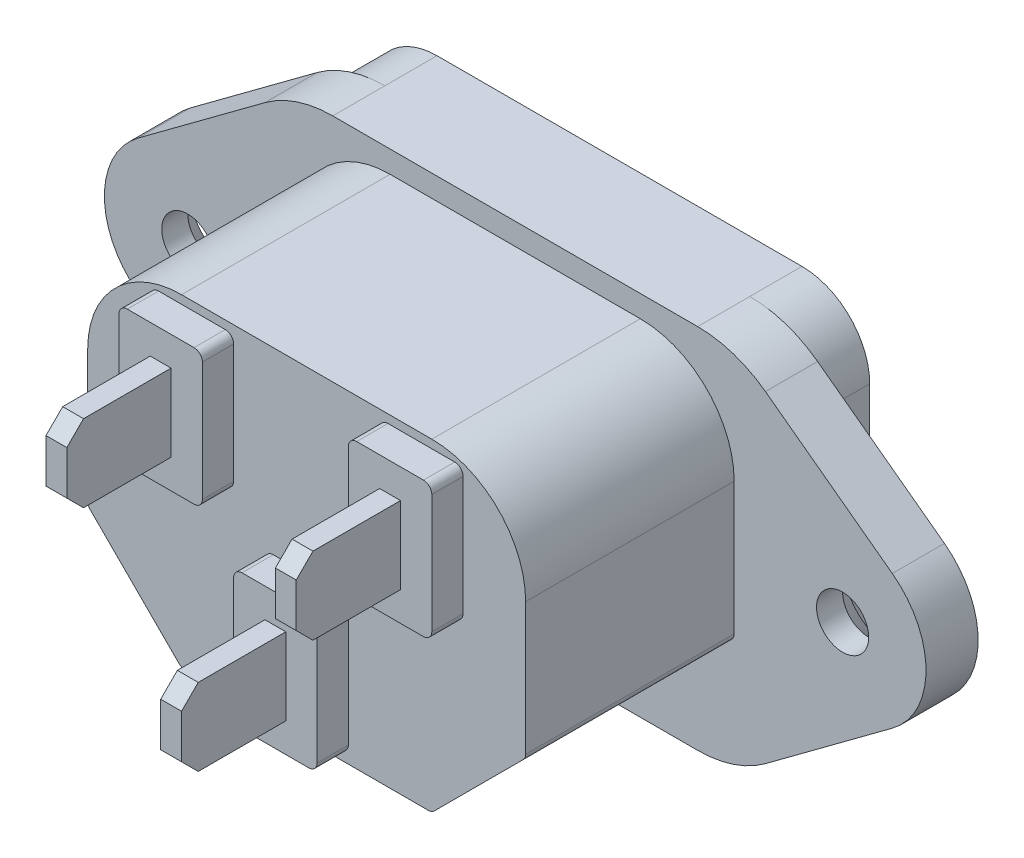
SolidWorks part; units mm, degrees
ref_plane "Front Plane" through (0, 0, 0) normal (0, 0, 1) x (1, 0, 0)
ref_plane "Top Plane" through (0, 0, 0) normal (0, 1, 0) x (1, 0, 0)
ref_plane "Right Plane" through (0, 0, 0) normal (1, 0, 0) x (0, 0, -1)
sketch "Sketch1" plane through (0, 0, 0) normal (0, 0, 1) x (1, 0, 0)
  line L0 (11.1125, 11.176) -> (-11.1125, 11.176)
  line L1 (11.1125, -11.176) -> (-11.1125, -11.176)
  line L2 (15.24, 9.812) -> (22.966, 4.0797)
  line L3 (15.24, -9.812) -> (22.966, -4.0797)
  line L4 (-15.24, 9.812) -> (-22.966, 4.0797)
  line L5 (-15.24, -9.812) -> (-22.966, -4.0797)
  line L6 (19.939, 0) -> (-19.939, 0) construction
  line L7 (0, 11.176) -> (0, -11.176) construction
  arc A0 (22.966, 4.0797) -> (22.966, -4.0797) centre (19.939, 0) cw
  arc A1 (-22.966, 4.0797) -> (-22.966, -4.0797) centre (-19.939, 0) ccw
  arc A2 (15.24, 9.812) -> (11.1125, 11.176) centre (11.1125, 4.249) ccw
  arc A3 (-11.1125, 11.176) -> (-15.24, 9.812) centre (-11.1125, 4.249) ccw
  arc A4 (-15.24, -9.812) -> (-11.1125, -11.176) centre (-11.1125, -4.249) ccw
  arc A5 (11.1125, -11.176) -> (15.24, -9.812) centre (11.1125, -4.249) ccw
  point P13 (0, 11.176)
  dimension "D3" = 22.352
  dimension "D2" = 50.038
  dimension "D4" = 5.08
  dimension "D1" = 22.225
  dimension "D6" = 30.48
extrude "Base-Extrude" add sketch "Sketch1" along normal blind 3.175
sketch "Sketch2" plane through (0, 0, 0) normal (0, 0, -1) x (-1, 0, 0)
  circle A0 centre (19.939, 0) radius 1.5875
  circle A1 centre (-19.939, 0) radius 1.5875
  dimension "D1" = 3.175
extrude "Cut-Extrude1" cut sketch "Sketch2" against normal through all
chamfer "Chamfer1" distance 1.5875 angle 45 2 edges at (-21.5265, 0, 0) (18.3515, 0, 0)
sketch "Sketch3" plane through (0, 0, 0) normal (0, 0, -1) x (-1, 0, 0)
  line L0 (-11.1125, 11.176) -> (11.1125, 11.176)
  line L1 (-11.1125, -11.176) -> (11.1125, -11.176)
  line L2 (15.24, 7.0485) -> (15.24, -7.0485)
  line L3 (-15.24, 7.0485) -> (-15.24, -7.0485)
  arc A0 (11.1125, 11.176) -> (15.24, 7.0485) centre (11.1125, 7.0485) cw
  arc A1 (-11.1125, 11.176) -> (-15.24, 7.0485) centre (-11.1125, 7.0485) ccw
  arc A2 (-11.1125, -11.176) -> (-15.24, -7.0485) centre (-11.1125, -7.0485) cw
  arc A3 (11.1125, -11.176) -> (15.24, -7.0485) centre (11.1125, -7.0485) ccw
  dimension "D1" = 30.48
extrude "Boss-Extrude1" add sketch "Sketch3" along normal blind 3.175
sketch "Sketch7" plane through (0, 0, 3.175) normal (0, 0, 1) x (1, 0, 0)
  line L0 (-7.62, 9.8425) -> (7.62, 9.8425)
  line L1 (13.335, 4.1275) -> (13.335, -4.1275)
  line L2 (-13.335, 4.1275) -> (-13.335, -4.1275)
  line L3 (-7.62, -9.8425) -> (7.62, -9.8425)
  line L4 (7.62, -9.8425) -> (13.335, -4.1275)
  line L5 (-7.62, -9.8425) -> (-13.335, -4.1275)
  line L14 (11.1125, -11.176) -> (-11.1125, -11.176) construction
  arc A0 (7.62, 9.8425) -> (13.335, 4.1275) centre (7.62, 4.1275) cw
  arc A1 (-7.62, 9.8425) -> (-13.335, 4.1275) centre (-7.62, 4.1275) ccw
  dimension "D1" = 1.3335
  dimension "D2" = 13.97
  dimension "D3" = 13.335
  dimension "D4" = 13.335
  dimension "D5" = 135
  dimension "D6" = 19.685
extrude "Boss-Extrude2" add sketch "Sketch7" along normal blind 12.7
sketch "Sketch5" plane through (0, 0, -3.175) normal (0, 0, -1) x (-1, 0, 0)
  line L0 (-8.509, 8.128) -> (8.509, 8.128)
  line L1 (12.192, 4.445) -> (12.192, -4.445)
  line L2 (12.192, -4.445) -> (8.509, -8.128)
  line L3 (-12.192, 4.445) -> (-12.192, -4.445)
  line L4 (-15.24, 7.0485) -> (-15.24, -7.0485) construction
  line L5 (-11.1125, 11.176) -> (11.1125, 11.176) construction
  line L7 (15.24, 7.0485) -> (15.24, -7.0485) construction
  line L8 (-12.192, -4.445) -> (-8.509, -8.128)
  line L9 (-8.509, -8.128) -> (8.509, -8.128)
  line L10 (-11.1125, -11.176) -> (11.1125, -11.176) construction
  arc A2 (12.192, 4.445) -> (8.509, 8.128) centre (8.509, 4.445) ccw
  arc A3 (-8.509, 8.128) -> (-12.192, 4.445) centre (-8.509, 4.445) ccw
  dimension "D5" = 135
  dimension "D1" = 3.048
  dimension "D2" = 3.048
  dimension "D3" = 3.048
  dimension "D4" = 3.048
  dimension "D6" = 8.89
sketch "Sketch8" plane through (0, 0, 15.875) normal (0, 0, 1) x (1, 0, 0)
  line L0 (-9.525, 9.3345) -> (-4.445, 9.3345)
  line L1 (-9.525, 9.3345) -> (-9.525, 1.0795)
  line L2 (-4.445, 1.0795) -> (-9.525, 1.0795)
  line L3 (-4.445, 1.0795) -> (-4.445, 9.3345)
  line L4 (4.445, 9.3345) -> (9.525, 9.3345)
  line L5 (4.445, 9.3345) -> (4.445, 1.0795)
  line L6 (9.525, 1.0795) -> (4.445, 1.0795)
  line L7 (9.525, 1.0795) -> (9.525, 9.3345)
  line L8 (-2.54, -1.0795) -> (2.54, -1.0795)
  line L9 (-2.54, -1.0795) -> (-2.54, -9.3345)
  line L10 (2.54, -9.3345) -> (-2.54, -9.3345)
  line L11 (2.54, -9.3345) -> (2.54, -1.0795)
  line L12 (13.335, 4.1275) -> (13.335, -4.1275) construction
  line L13 (-7.62, 9.8425) -> (7.62, 9.8425) construction
  line L14 (-7.62, -9.8425) -> (7.62, -9.8425) construction
  line L15 (-13.335, 4.1275) -> (-13.335, -4.1275) construction
  dimension "D1" = 5.08
  dimension "D2" = 8.255
  dimension "D3" = 8.89
  dimension "D4" = 0.508
  dimension "D5" = 15.875
  dimension "D6" = 0.508
  dimension "D7" = 8.89
extrude "Boss-Extrude3" add sketch "Sketch8" along normal blind 1.905
fillet "Fillet2" radius 0.508 12 edges at (-4.445, 1.0795, 16.8275) (-4.445, 9.3345, 16.8275) (4.445, 9.3345, 16.8275) (4.445, 1.0795, 16.8275) (9.525, 1.0795, 16.8275) (9.525, 9.3345, 16.8275) (-2.54, -1.0795, 16.8275) (-2.54, -9.3345, 16.8275) (2.54, -9.3345, 16.8275) (2.54, -1.0795, 16.8275) (-9.525, 9.3345, 16.8275) (-9.525, 1.0795, 16.8275)
extrude "Cut-Extrude3" cut sketch "Sketch5" against normal blind 16.51
fillet "Fillet4" radius 0.508 8 edges at (-12.192, -4.445, 5.08) (-8.509, -8.128, 5.08) (8.509, -8.128, 5.08) (12.192, -4.445, 5.08) (-13.335, -4.1275, 9.525) (-7.62, -9.8425, 9.525) (7.62, -9.8425, 9.525) (13.335, -4.1275, 9.525)
sketch "Sketch10" plane through (0, 0, 17.78) normal (0, 0, 1) x (1, 0, 0)
  line L0 (6.35, 7.5565) -> (7.62, 7.5565)
  line L1 (6.35, 7.5565) -> (6.35, 2.8575)
  line L2 (7.62, 2.8575) -> (6.35, 2.8575)
  line L3 (7.62, 2.8575) -> (7.62, 7.5565)
  line L4 (-7.62, 7.5565) -> (-6.35, 7.5565)
  line L5 (-7.62, 7.5565) -> (-7.62, 2.8575)
  line L6 (-6.35, 2.8575) -> (-7.62, 2.8575)
  line L7 (-6.35, 2.8575) -> (-6.35, 7.5565)
  line L8 (-0.635, -2.8575) -> (0.635, -2.8575)
  line L9 (-0.635, -2.8575) -> (-0.635, -7.5565)
  line L10 (0.635, -7.5565) -> (-0.635, -7.5565)
  line L11 (0.635, -7.5565) -> (0.635, -2.8575)
  line L12 (-7.62, 2.8575) -> (-6.35, 7.5565) construction
  line L13 (6.35, 2.8575) -> (7.62, 7.5565) construction
  line L16 (-0.635, -7.5565) -> (0.635, -2.8575) construction
  line L17 (-2.032, -1.5875) -> (2.032, -8.8265) construction
  line L20 (-9.017, 8.8265) -> (-4.953, 1.5875) construction
  line L21 (4.953, 8.8265) -> (9.017, 1.5875) construction
  point P18 (-6.985, 5.207)
  point P19 (6.985, 5.207)
  point P20 (0, -5.207)
  dimension "D1" = 1.27
  dimension "D2" = 4.699
extrude "Boss-Extrude4" add sketch "Sketch10" along normal blind 6.35
chamfer "Chamfer2" distance 1.016 angle 45 6 edges at (6.985, 2.8575, 24.13) (6.985, 7.5565, 24.13) (-6.985, 2.8575, 24.13) (-6.985, 7.5565, 24.13) (0, -7.5565, 24.13) (0, -2.8575, 24.13)
sketch "Sketch11" plane through (0, 0, 13.335) normal (0, 0, -1) x (-1, 0, 0)
  line L0 (8.001, 4.318) -> (6.096, 4.318)
  line L1 (8.001, 4.318) -> (8.001, 0.254)
  line L2 (6.096, 0.254) -> (8.001, 0.254)
  line L3 (6.096, 0.254) -> (6.096, 4.318)
  line L4 (-6.096, 4.318) -> (-8.001, 4.318)
  line L5 (-6.096, 4.318) -> (-6.096, 0.254)
  line L6 (-8.001, 0.254) -> (-6.096, 0.254)
  line L7 (-8.001, 0.254) -> (-8.001, 4.318)
  line L9 (12.192, 4.445) -> (12.192, -4.2346) construction
  line L10 (-8.509, 8.128) -> (8.509, 8.128) construction
  line L11 (-12.192, 4.445) -> (-12.192, -4.2346) construction
  dimension "D1" = 6.096
  dimension "D2" = 1.905
  dimension "D3" = 4.064
  dimension "D4" = 7.874
  dimension "D5" = 6.096
  dimension "D6" = 1.905
  dimension "D7" = 4.064
  dimension "D8" = 7.874
extrude "Boss-Extrude5" add sketch "Sketch11" along normal blind 14.605
sketch "Sketch12" plane through (0, 0, 13.335) normal (0, 0, -1) x (-1, 0, 0)
  line L0 (0.762, 0.127) -> (-1.143, 0.127)
  line L1 (0.762, 0.127) -> (0.762, -3.937)
  line L2 (-1.143, -3.937) -> (0.762, -3.937)
  line L3 (-1.143, -3.937) -> (-1.143, 0.127)
  line L4 (-8.2986, -8.128) -> (8.2986, -8.128) construction
  line L5 (12.192, 4.445) -> (12.192, -4.2346) construction
  dimension "D1" = 8.255
  dimension "D2" = 4.064
  dimension "D3" = 1.905
  dimension "D4" = 13.335
extrude "Boss-Extrude6" add sketch "Sketch12" along normal blind 17.78
chamfer "Chamfer11" distance 0.8128 angle 45 12 edges at (-8.001, 2.286, -1.27) (-6.096, 2.286, -1.27) (-7.0485, 4.318, -1.27) (-7.0485, 0.254, -1.27) (6.096, 2.286, -1.27) (8.001, 2.286, -1.27) (7.0485, 4.318, -1.27) (7.0485, 0.254, -1.27) (-0.762, -1.905, -4.445) (1.143, -1.905, -4.445) (0.1905, 0.127, -4.445) (0.1905, -3.937, -4.445)
ref_plane "Plane1" through (0, 5.207, 0) normal (0, 1, 0) x (-1, 0, 0)
ref_plane "Plane2" through (0, -5.207, 0) normal (0, 1, 0) x (-1, 0, 0)
ref_plane "Plane3" through (-6.985, 0, 0) normal (1, 0, 0) x (0, 0, -1)
ref_plane "Plane4" through (6.985, 0, 0) normal (1, 0, 0) x (0, 0, -1)
